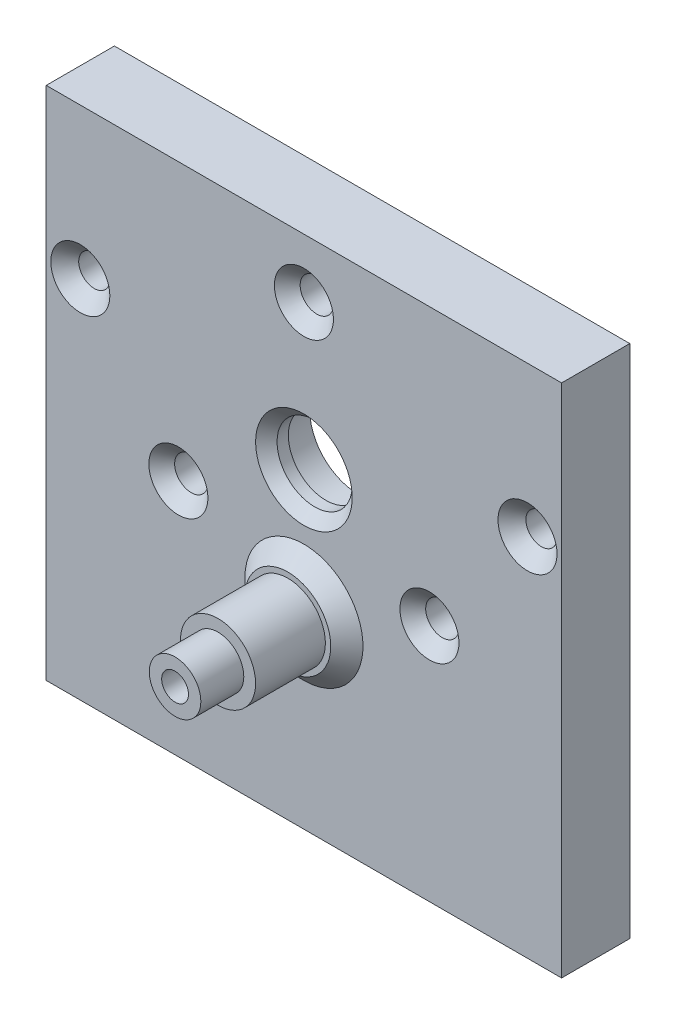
SolidWorks part; units mm, degrees
ref_plane "Plano frontal" through (0, 0, 0) normal (0, 0, 1) x (1, 0, 0)
ref_plane "Plano superior" through (0, 0, 0) normal (0, 1, 0) x (1, 0, 0)
ref_plane "Plano direito" through (0, 0, 0) normal (1, 0, 0) x (0, 0, -1)
sketch "Esboço1" plane through (0, 0, 0) normal (0, 0, 1) x (1, 0, 0)
  line L0 (24, 0) -> (24, 48) construction
  line L1 (0, 0) -> (48, 0)
  line L2 (0, 0) -> (0, 48)
  line L3 (0, 48) -> (48, 48)
  line L4 (48, 0) -> (48, 48)
  dimension "D1" = 48
  dimension "D2" = 48
extrude "Ressalto-extrusão1" add sketch "Esboço1" along normal blind 6.35
sketch "Esboço3" plane through (0, 0, 6.35) normal (0, 0, 1) x (1, 0, 0)
  line L0 (24, 48) -> (24, 0) construction
  line L1 (48, 48) -> (0, 48) construction
  line L2 (0, 0) -> (48, 0) construction
  circle A0 centre (24, 17.5) radius 6
  point P6 (24, 17.5)
  dimension "D2" = 12
  dimension "D1" = 17.5
extrude "Ressalto-extrusão2" add sketch "Esboço3" along normal blind 12
sketch "Esboço4" plane through (0, 0, 18.35) normal (0, 0, 1) x (1, 0, 0)
  circle A0 centre (24, 17.5) radius 6
  circle A1 centre (24, 17.5) radius 2.4
  dimension "D1" = 12
  dimension "D2" = 4.8
extrude "Corte-extrusão1" cut sketch "Esboço4" against normal blind 4
sketch "Esboço5" plane through (0, 0, 14.35) normal (0, 0, 1) x (1, 0, 0)
  circle A0 centre (24, 17.5) radius 6
  circle A1 centre (24, 17.5) radius 3.5
  dimension "D1" = 7
  dimension "D2" = 12
extrude "Corte-extrusão2" cut sketch "Esboço5" against normal blind 6.5
sketch "Esboço10" plane through (0, 0, 18.35) normal (0, 0, 1) x (1, 0, 0)
  point P0 (24, 17.5)
hole_wizard "Furo roscado de M31" positions "3DSketch3" profile "Esboço11" tap size "M3" standard "ISO"
sketch3d "3DSketch3"
  point P0 (24, 17.5, 18.35)
sketch "Esboço11" plane through (24, 17.5, 18.35) normal (1, 0, 0) x (0, -1, 0)
  line L0 (0, 0) -> (0, 9.2511)
  line L1 (0, 9.2511) -> (1.25, 8.5)
  line L2 (1.25, 8.5) -> (1.25, 0)
  line L5 (1.25, 0) -> (0, 0)
  line L10 (0, 9.2511) -> (-1.25, 8.5) construction
  line L11 (0, -6.35) -> (0, 107.95) construction
  dimension "Tap Drill Dia." = 2.5
  dimension "Tap Drill Depth" = 8.5
  dimension "Drill Angle" = 118
sketch "Esboço12" plane through (0, 0, 0) normal (0, 0, -1) x (-1, 0, 0)
  line L0 (-24, 17.5) -> (-24, 29) construction
  circle A0 centre (-24, 29) radius 17.5
  dimension "D2" = 35
  dimension "D1" = 11.5
extrude "Corte-extrusão3" cut sketch "Esboço12" against normal blind 1.3
sketch "Esboço13" plane through (0, 0, 1.3) normal (0, 0, -1) x (-1, 0, 0)
  line L0 (-24, 17.5) -> (-24, 29) construction
  circle A0 centre (-24, 29) radius 4.5
  dimension "D2" = 9
  dimension "D1" = 11.5
extrude "Corte-extrusão4" cut sketch "Esboço13" against normal blind 3
sketch "Esboço14" plane through (0, 0, 4.3) normal (0, 0, -1) x (-1, 0, 0)
  circle A0 centre (-24, 29) radius 3.5
  point P0 (-24, 29)
  dimension "D1" = 7
extrude "Corte-extrusão5" cut sketch "Esboço14" against normal blind 10 contours A0
sketch "Esboço15" plane through (0, 0, 6.35) normal (0, 0, 1) x (1, 0, 0)
  line L0 (0, 48) -> (3.175, 48) construction
  line L1 (48, 48) -> (0, 48) construction
  line L2 (3.175, 48) -> (3.175, 28) construction
  line L3 (48, 48) -> (44.825, 48) construction
  line L4 (44.825, 48) -> (44.825, 28) construction
  point P5 (3.175, 34)
  point P10 (44.825, 34)
  dimension "D1" = 3.175
  dimension "D2" = 20
  dimension "D3" = 14
  dimension "D4" = 3.175
  dimension "D5" = 20
  dimension "D6" = 14
sketch "Esboço17" plane through (0, 0, 0) normal (0, -1, 0) x (1, 0, 0)
  line L0 (3.175, 6.35) -> (3.175, 0) construction
  line L1 (0, 0) -> (48, 0) construction
  line L2 (44.825, 6.35) -> (44.825, 0) construction
  point P8 (3.175, 3.175)
  point P9 (44.825, 3.175)
hole_wizard "Escareado para parafuso com cabeça escareada chata de M2.52" positions "3DSketch6" profile "Esboço19" countersink size "M2.5" standard "ISO"
sketch3d "3DSketch6"
  line L0 (44.825, 0, 6.35) -> (44.825, 0, 0) construction
  point P0 (44.825, 34, 6.35)
  point P3 (3.175, 34, 6.35)
  point P6 (44.825, 0, 3.175)
  point P10 (44.825, 0, 3.175)
sketch "Esboço19" plane through (44.825, 34, 6.35) normal (1, 0, 0) x (0, -1, 0)
  line L0 (0, 0) -> (0, 11.8)
  line L1 (0, 11.8) -> (1.45, 10.9288)
  line L2 (1.45, 10.9288) -> (1.45, 1.3)
  line L3 (1.45, 1.3) -> (2.75, 0)
  line L5 (2.75, 0) -> (0, 0)
  line L6 (-1.45, 1.3) -> (-2.75, 0) construction
  line L10 (0, 11.8) -> (-1.45, 10.9288) construction
  line L11 (0, -6.35) -> (0, 107.95) construction
  dimension "Hole Dia." = 2.9
  dimension "Hole Depth" = 11.8
  dimension "Near C'Sink Dia." = 5.5
  dimension "Near C'Sink Angle" = 90
  dimension "Drill Angle" = 118
hole_wizard "Furo roscado de M2.51" positions "3DSketch8" profile "Esboço21" tap size "M2.5" standard "ISO"
sketch3d "3DSketch8"
  point P0 (3.175, 0, 3.175)
  point P3 (44.825, 0, 3.175)
sketch "Esboço21" plane through (3.175, 0, 3.175) normal (1, 0, 0) x (0, 0, -1)
  line L0 (0, 0) -> (0, 10)
  line L1 (0, 10) -> (1.025, 9.3841)
  line L2 (1.025, 9.3841) -> (1.025, 0)
  line L5 (1.025, 0) -> (0, 0)
  line L10 (0, 10) -> (-1.025, 9.3841) construction
  line L11 (0, -6.35) -> (0, 107.95) construction
  dimension "Tap Drill Dia." = 2.05
  dimension "Tap Drill Depth" = 10
  dimension "Drill Angle" = 118
chamfer "Chanfro2" distance 1 angle 45 1 edges at (20.5, 29, 6.35)
chamfer "Chanfro4" distance 2 angle 45 1 edges at (30, 17.5, 7.85)
sketch "Esboço26" plane through (0, 0, 6.35) normal (0, 0, 1) x (1, 0, 0)
  circle A0 centre (24, 29) radius 13.5 construction
  point P3 (24, 42.5)
  dimension "D1" = 27
hole_wizard "Escareado para parafuso com cabeça escareada chata de M2.54" positions "3DSketch11" profile "Esboço27" countersink size "M2.5" standard "ISO"
sketch3d "3DSketch11"
  point P0 (24, 42.5, 6.35)
sketch "Esboço27" plane through (24, 42.5, 6.35) normal (1, 0, 0) x (0, -1, 0)
  line L0 (0, 0) -> (0, 6)
  line L1 (0, 6) -> (1.55, 5.0687)
  line L2 (1.55, 5.0687) -> (1.55, 1.2)
  line L3 (1.55, 1.2) -> (2.75, 0)
  line L5 (2.75, 0) -> (0, 0)
  line L6 (-1.55, 1.2) -> (-2.75, 0) construction
  line L10 (0, 6) -> (-1.55, 5.0687) construction
  line L11 (0, -6.35) -> (0, 107.95) construction
  dimension "Hole Dia." = 3.1
  dimension "Hole Depth" = 6
  dimension "Near C'Sink Dia." = 5.5
  dimension "Near C'Sink Angle" = 90
  dimension "Drill Angle" = 118
pattern_circular "PadrãoCircular2" count 3 over 360 about axis through (24, 29, 0) along (0, 0, 1) of "Escareado para parafuso com cabeça escareada chata de M2.54"
